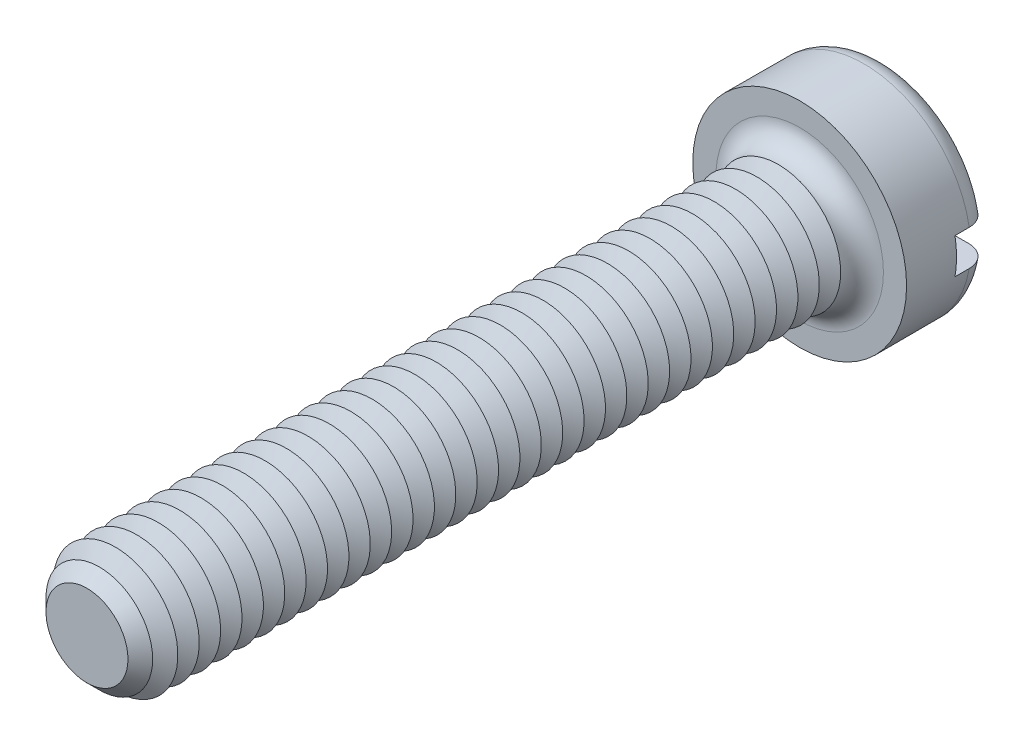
SolidWorks part; units mm, degrees
ref_plane "Front Plane" through (0, 0, 0) normal (0, 0, 1) x (1, 0, 0)
ref_plane "Top Plane" through (0, 0, 0) normal (0, 1, 0) x (1, 0, 0)
ref_plane "Right Plane" through (0, 0, 0) normal (1, 0, 0) x (0, 0, -1)
sketch "Sketch3" plane through (0, 0, 0) normal (0, 0, 1) x (1, 0, 0)
  circle A0 centre (0, 0) radius 3
  dimension "D1" = 6
extrude "Boss-Extrude2" add sketch "Sketch3" against normal blind 2.4
sketch "Sketch4" plane through (0, 0, 0) normal (0, 0, 1) x (1, 0, 0)
  circle A0 centre (0, 0) radius 1.75
  dimension "D1" = 3.5
extrude "Boss-Extrude3" add sketch "Sketch4" along normal blind 20
fillet "Fillet1" radius 0.6 2 edges at (3, 0, -2.4) (1.75, 0, 0)
chamfer "Chamfer1" distance 0.6 angle 45 1 edges at (1.75, 0, 20)
sketch "Sketch5" plane through (0, 0, 0) normal (1, 0, 0) x (0, 0, -1)
  line L0 (1.6944, 0) -> (-7.6738, 0) construction
sketch "Sketch6" plane through (0, 0, 0) normal (1, 0, 0) x (0, 0, -1)
  line L0 (-0.6, 1.75) -> (-0.9, 1.2304)
  line L1 (-0.9, 1.2304) -> (-1.2, 1.75)
  line L2 (-0.6, 1.75) -> (-19.4, 1.75) construction
  line L3 (-1.2, 1.75) -> (-0.6, 1.75)
  dimension "D1" = 0.6
revolve "Cut-Revolve1" cut sketch "Sketch6" angle 360 about L0
pattern_linear "LPattern1" count 32 spacing 0.6 along (0, 0, 1) of "Cut-Revolve1"
sketch "Sketch8" plane through (0, 0, -2.4) normal (0, 0, -1) x (-1, 0, 0)
  line L1 (3, -0.5) -> (-3, -0.5)
  line L2 (3, -0.5) -> (3, 0.5)
  line L3 (3, 0.5) -> (-3, 0.5)
  line L4 (-3, -0.5) -> (-3, 0.5)
  line L5 (3, -0.5) -> (-3, 0.5) construction
  line L6 (3, 0.5) -> (-3, -0.5) construction
  point P0 (0, 0)
  dimension "D1" = 6
  dimension "D2" = 1
extrude "Cut-Extrude1" cut sketch "Sketch8" against normal blind 1
